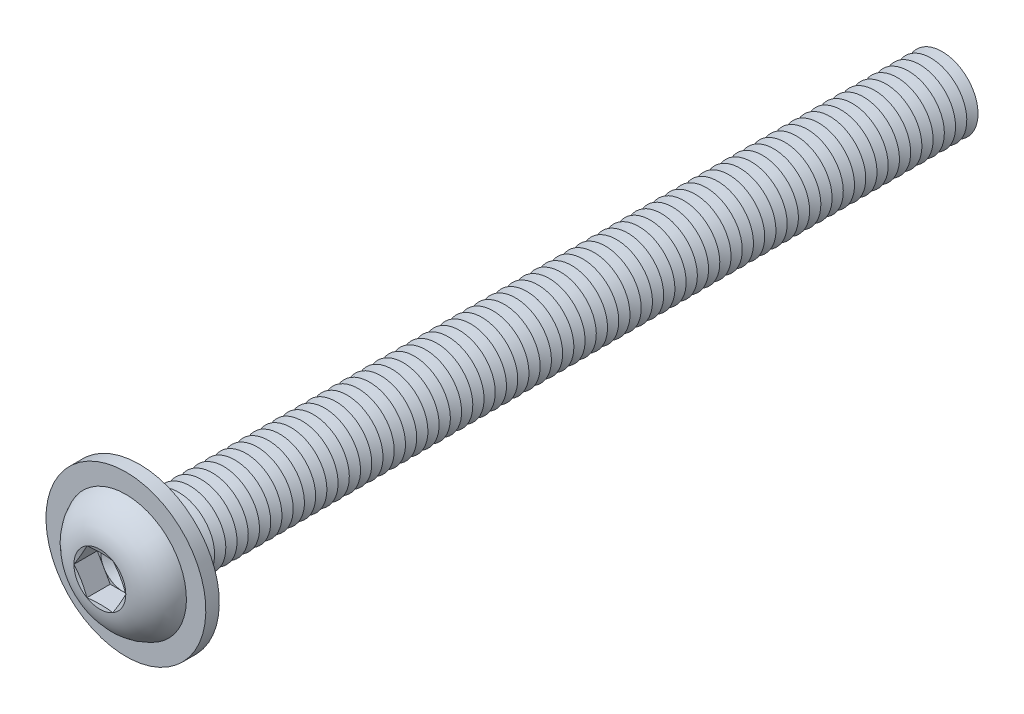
SolidWorks part; units mm, degrees
ref_plane "Front Plane" through (0, 0, 0) normal (0, 0, 1) x (1, 0, 0)
ref_plane "Top Plane" through (0, 0, 0) normal (0, 1, 0) x (1, 0, 0)
ref_plane "Right Plane" through (0, 0, 0) normal (1, 0, 0) x (0, 0, -1)
sketch "Sketch1" plane through (0, 0, 0) normal (1, 0, 0) x (0, 0, -1)
  line L0 (0, 4) -> (0, 7)
  line L3 (0, 4) -> (90, 4)
  line L4 (90, 4) -> (90, 0)
  line L5 (90, 0) -> (-4.4, 0) construction
  line L6 (-4.4, 0) -> (90, 0)
  line L7 (-4.4, 2.8867) -> (-4.4, 1.4434) construction
  line L8 (-4.4, 1.4434) -> (-4.4, 0)
  line L9 (-4.4, 2.8867) -> (-4.0132, 1.4434)
  line L10 (-4.0132, 1.4434) -> (-4.4, 1.4434)
  line L11 (90, 0) -> (22.7481, 0) construction
  line L12 (0, 7) -> (-4.4, 7) construction
  arc A1 (0, 7) -> (-4.4, 2.8867) centre (0, 2.59) ccw
  point P8 (90, 2)
  dimension "D1" = 14
  dimension "D2" = 8
  dimension "D3" = 4.4
  dimension "D4" = 5.7735
  dimension "D5" = 90
  dimension "D6" = 15
revolve "Revolve1" add sketch "Sketch1" angle 360 about L5
fillet "Fillet1" radius 0.625 1 edges at (0, 4, 0)
sketch "Sketch2" plane through (0, 0, 0) normal (1, 0, 0) x (0, 0, -1)
  line L0 (89.375, 4) -> (90.625, 4)
  line L1 (90, 4) -> (0.625, 4) construction
  line L2 (90.625, 4) -> (90, 2.9175)
  line L3 (90, -4) -> (90, 4) construction
  line L4 (90, 2.9175) -> (89.375, 4)
  dimension "D1" = 1.25
revolve "Cut-Revolve1" cut sketch "Sketch2" angle 360 about axis through (0, 0, -90) along (0, 0, -1)
pattern_linear "LPattern1" count 72 spacing 1.25 along (0, 0, 1) of "Cut-Revolve1"
sketch "Sketch3" plane through (0, 0, 4.4) normal (0, 0, 1) x (1, 0, 0)
  line L7 (1.4434, 2.5) -> (-1.4434, 2.5)
  line L8 (-1.4434, 2.5) -> (-2.8867, 0)
  line L9 (-2.8867, 0) -> (-1.4434, -2.5)
  line L10 (-1.4434, -2.5) -> (1.4434, -2.5)
  line L11 (1.4434, -2.5) -> (2.8867, 0)
  line L12 (2.8867, 0) -> (1.4434, 2.5)
  circle A0 centre (0, 0) radius 2.5 construction
  circle A3 centre (0, 0) radius 2.8867 construction
extrude "Cut-Extrude1" cut sketch "Sketch3" against normal blind 2.6
sketch "Sketch4" plane through (0, 0, 1.8) normal (0, 0, 1) x (1, 0, 0)
  line L1 (1.4434, 2.5) -> (-1.4434, 2.5) construction
  circle A0 centre (0, 0) radius 2.5
extrude "Cut-Extrude2" cut sketch "Sketch4" against normal through all draft 60
sketch "Sketch5" plane through (0, 0, 0) normal (0, 0, -1) x (-1, 0, 0)
  circle A0 centre (0, 0) radius 8.9
  circle A1 centre (0, 0) radius 4.625
  circle A2 centre (0, 0) radius 4.625 construction
  dimension "D1" = 17.8
extrude "Boss-Extrude1" add sketch "Sketch5" against normal blind 1.5
